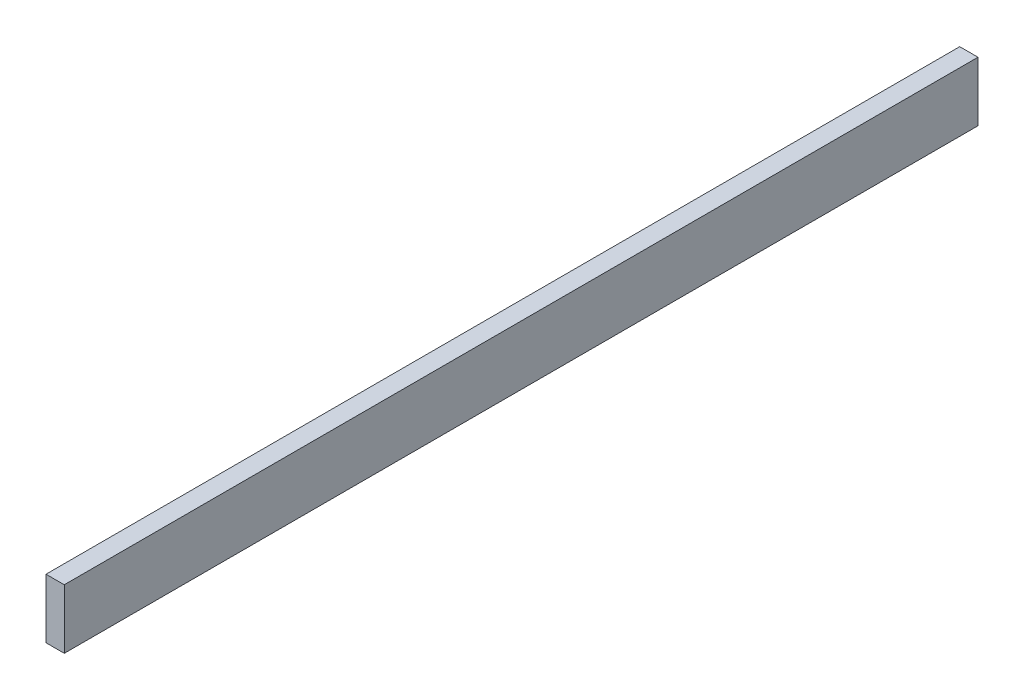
SolidWorks part; units mm, degrees
ref_plane "Plan de face" through (0, 0, 0) normal (0, 0, 1) x (1, 0, 0)
ref_plane "Plan de dessus" through (0, 0, 0) normal (0, 1, 0) x (1, 0, 0)
ref_plane "Plan de droite" through (0, 0, 0) normal (1, 0, 0) x (0, 0, -1)
sketch "Esquisse1" plane through (0, 0, 0) normal (0, 0, 1) x (1, 0, 0)
  line L1 (-2, 6.5) -> (2, 6.5)
  line L2 (-2, 6.5) -> (-2, -6.5)
  line L3 (-2, -6.5) -> (2, -6.5)
  line L4 (2, 6.5) -> (2, -6.5)
  point P4 (0, 6.5)
  point P5 (-2, 0)
  dimension "D1" = 4
  dimension "D2" = 13
extrude "Extrusion1" add sketch "Esquisse1" along normal mid plane 200
